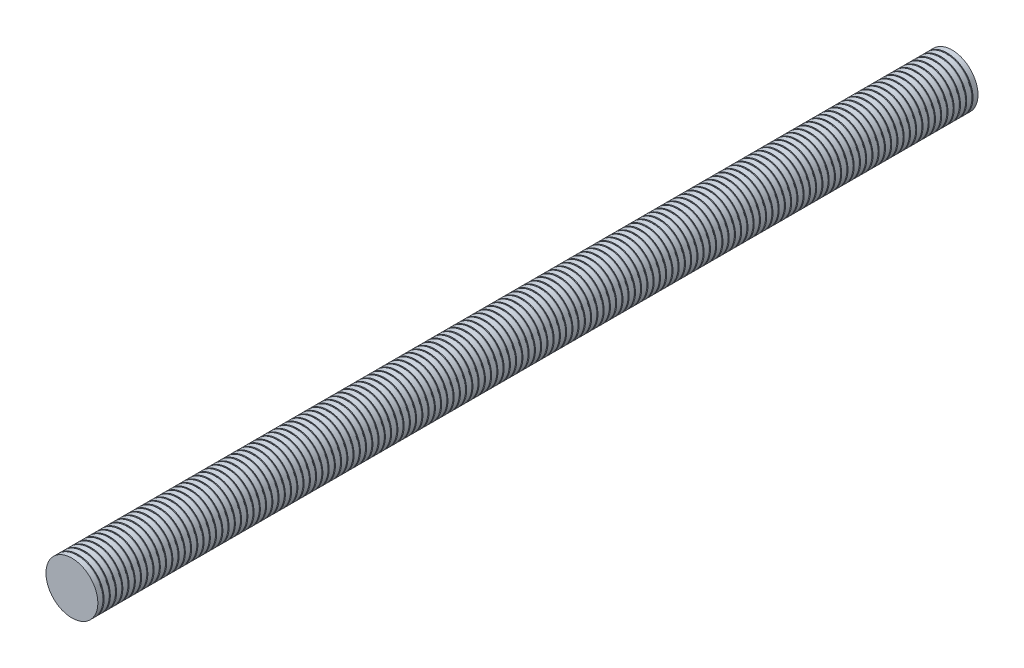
SolidWorks part; units mm, degrees
ref_plane "Front Plane" through (0, 0, 0) normal (0, 0, 1) x (1, 0, 0)
ref_plane "Top Plane" through (0, 0, 0) normal (0, 1, 0) x (1, 0, 0)
ref_plane "Right Plane" through (0, 0, 0) normal (1, 0, 0) x (0, 0, -1)
sketch "Sketch1" plane through (0, 0, 0) normal (0, 0, 1) x (1, 0, 0)
  circle A0 centre (0, 0) radius 2
  dimension "D1" = 4
extrude "Boss-Extrude1" add sketch "Sketch1" along normal blind 70
sketch "Sketch2" plane through (0, 0, 70) normal (0, 0, 1) x (1, 0, 0)
  circle A0 centre (0, 0) radius 2.0755
extrude "Boss-Extrude2" add sketch "Sketch2" along normal blind 0.4
pattern_linear "LPattern1" count 141 spacing 0.5 along (0, 0, -1) of "Boss-Extrude2"
